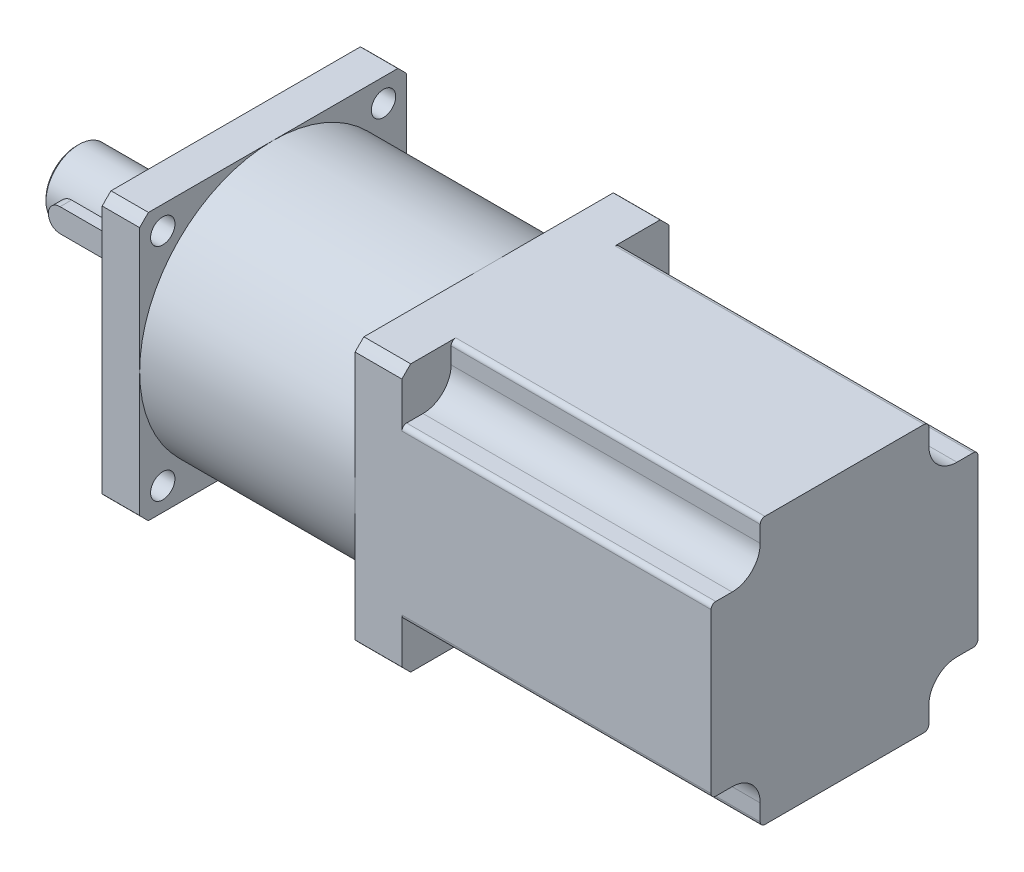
SolidWorks part; units mm, degrees
ref_plane "Plan1" through (0, 0, 0) normal (0, 0, 1) x (1, 0, 0)
ref_plane "Plan2" through (0, 0, 0) normal (0, 1, 0) x (1, 0, 0)
ref_plane "Plan3" through (0, 0, 0) normal (1, 0, 0) x (0, 0, -1)
sketch "Esquisse1" plane through (0, 0, 0) normal (0, 0, 1) x (1, 0, 0)
  line L0 (-41.0735, 0) -> (137.2136, 0) construction
  line L1 (50, 0) -> (-50, 0) construction
  line L2 (-2.5, 0) -> (-2.5, 20)
  line L3 (-2.5, 20) -> (0, 20)
  line L4 (0, 20) -> (0, 39)
  line L5 (8, 28.5) -> (54, 28.5)
  line L6 (54, 28.5) -> (54, 39)
  line L7 (54, 39) -> (130, 39)
  line L8 (130, 39) -> (130, 0)
  line L9 (130, 0) -> (-2.5, 0)
  line L10 (0, -50) -> (0, 50) construction
  line L11 (0, 39) -> (8, 39)
  line L12 (8, 39) -> (8, 28.5)
  dimension "D1" = 40
  dimension "D2" = 2.5
  dimension "D3" = 57
  dimension "D4" = 54
  dimension "D5" = 76
  dimension "D6" = 78
  dimension "D7" = 8
revolve "Révolution1" add sketch "Esquisse1" angle 360 about L0
sketch "Esquisse2" plane through (0, 0, 0) normal (0, 0, 1) x (1, 0, 0)
  line L0 (-41.2245, 0) -> (7.59, 0) construction
  line L1 (50, 0) -> (-50, 0) construction
  line L2 (-2.5, 20) -> (-2.5, -20) construction
  line L3 (-34, 7) -> (-2.5, 7)
  line L4 (-34, 7) -> (-34, 0)
  line L5 (-34, 0) -> (-2.5, 0)
  line L6 (-2.5, 7) -> (-2.5, 0)
  line L7 (0, 28.5) -> (0, -28.5) construction
  dimension "D1" = 14
  dimension "D2" = 34
revolve "Révolution2" add sketch "Esquisse2" angle 360 about L0
sketch "Esquisse3" plane through (0, 0, 0) normal (0, 0, 1) x (1, 0, 0)
  line L0 (-28.5, 0) -> (-8.5, 0) construction
  line L1 (-28.5, 2.5) -> (-8.5, 2.5)
  line L2 (-28.5, -2.5) -> (-8.5, -2.5)
  line L3 (-34, 7) -> (-34, -7) construction
  arc A0 (-28.5, 2.5) -> (-28.5, -2.5) centre (-28.5, 0) ccw
  arc A1 (-8.5, -2.5) -> (-8.5, 2.5) centre (-8.5, 0) ccw
  point P2 (-18.5, 0)
  dimension "D1" = 3
  dimension "D2" = 25
  dimension "D3" = 5
extrude "Boss.-Extru.1" add sketch "Esquisse3" along normal blind 9 separate body
chamfer "Chanfrein1" distance 0.5 angle 45 1 edges at (-34, -7, 0)
hole_wizard "Diamètre du perçage Ø5.2 (5.2)1" positions "Esquisse4" profile "Esquisse5" hole size "Ø5.2" standard "ISO"
sketch "Esquisse4" plane through (0, 0, 0) normal (-1, 0, 0) x (0, 0, 1)
  line L0 (0, 18.2061) -> (0, 0) construction
  line L1 (0, 0) -> (9.7414, 0) construction
  line L3 (-23.57, -23.57) -> (-23.57, 23.57)
  line L4 (-23.57, 23.57) -> (23.57, 23.57)
  point P5 (-23.57, 23.57)
  point P7 (23.57, 23.57)
  point P9 (23.57, -23.57)
  point P11 (-23.57, -23.57)
  dimension "D1" = 47.14
sketch "Esquisse5" plane through (0, 23.57, -23.57) normal (0, 1, 0) x (0, 0, 1)
  line L0 (0, 0) -> (0, 11.6622)
  line L1 (0, 11.6622) -> (2.6, 10.1)
  line L2 (2.6, 10.1) -> (2.6, 0)
  line L5 (2.6, 0) -> (0, 0)
  line L10 (0, 11.6622) -> (-2.6, 10.1) construction
  line L11 (0, -6.35) -> (0, 107.95) construction
  dimension "Diamètre du perçage" = 5.2
  dimension "Profondeur du perçage" = 10.1
  dimension "Angle de pointe" = 118
sketch "Esquisse6" plane through (0, 0, 0) normal (-1, 0, 0) x (0, 0, 1)
  line L1 (28.5, -28.5) -> (28.5, 28.5)
  line L2 (28.5, 28.5) -> (-28.5, 28.5)
  line L3 (-28.5, 28.5) -> (-28.5, -28.5)
  line L4 (-28.5, -28.5) -> (28.5, -28.5)
  circle A0 centre (0, 0) radius 28.5 construction
  dimension "D1" = 57
extrude "Enlèv. mat.-Extru.1" cut sketch "Esquisse6" against normal through all flip side to cut
sketch "Esquisse7" plane through (130, 0, 0) normal (1, 0, 0) x (0, 0, -1)
  line L0 (0, 31.6105) -> (0, 0) construction
  line L1 (0, 0) -> (36.6408, 0) construction
  line L2 (-26.6224, 28.5) -> (26.6224, 28.5) construction
  line L3 (-28.5, 28.5) -> (-18, 28.5)
  line L4 (-28.5, 28.5) -> (-28.5, 18)
  line L5 (-28.5, 18) -> (-24, 18)
  line L6 (-18, 28.5) -> (-18, 24)
  line L7 (-28.5, -26.6224) -> (-28.5, 26.6224) construction
  line L8 (28.5, 26.6224) -> (28.5, -26.6224) construction
  line L9 (18, 28.5) -> (28.5, 28.5)
  line L10 (18, 28.5) -> (18, 24)
  line L11 (24, 18) -> (28.5, 18)
  line L12 (28.5, 28.5) -> (28.5, 18)
  line L13 (-28.5, -18) -> (-24, -18)
  line L14 (-28.5, -18) -> (-28.5, -28.5)
  line L15 (-28.5, -28.5) -> (-18, -28.5)
  line L16 (-18, -24) -> (-18, -28.5)
  line L17 (24, -18) -> (28.5, -18)
  line L18 (18, -24) -> (18, -28.5)
  line L19 (18, -28.5) -> (28.5, -28.5)
  line L20 (28.5, -18) -> (28.5, -28.5)
  line L21 (26.6224, -28.5) -> (-26.6224, -28.5) construction
  line L22 (-24, -24) -> (-24, 24) construction
  line L23 (-24, 24) -> (24, 24) construction
  arc A0 (-24, 18) -> (-18, 24) centre (-24, 24) ccw
  arc A1 (24, 18) -> (18, 24) centre (24, 24) cw
  arc A2 (-24, -18) -> (-18, -24) centre (-24, -24) cw
  arc A3 (18, -24) -> (24, -18) centre (24, -24) cw
  dimension "D1" = 48
  dimension "D3" = 6
extrude "Enlèv. mat.-Extru.2" cut sketch "Esquisse7" against normal offset from surface (66 mm away) 10
fillet "Congé1" radius 1 8 edges at (97, -28.5, -18) (97, -18, -28.5) (97, -28.5, 18) (97, -18, 28.5) (97, 18, -28.5) (97, 28.5, -18) (97, 28.5, 18) (97, 18, 28.5)
